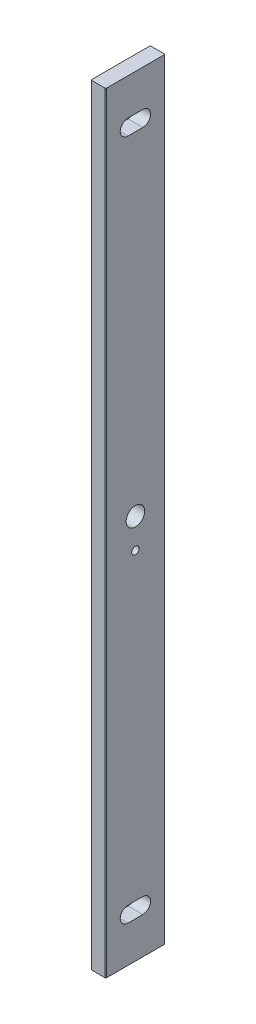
SolidWorks part; units mm, degrees
ref_plane "Plan de face" through (0, 0, 0) normal (0, 0, 1) x (1, 0, 0)
ref_plane "Plan de dessus" through (0, 0, 0) normal (0, 1, 0) x (1, 0, 0)
ref_plane "Plan de droite" through (0, 0, 0) normal (1, 0, 0) x (0, 0, -1)
ref_plane "Plan1" through (-5, 0, 0) normal (-1, 0, 0) x (0, -1, 0)
sketch "Esquisse1" plane through (-5, 0, 0) normal (-1, 0, 0) x (0, -1, 0)
  line L0 (-260, 20) -> (-260, -20)
  line L1 (-260, -20) -> (260, -20)
  line L2 (260, -20) -> (260, 20)
  line L3 (260, 20) -> (-260, 20)
extrude "Boss.-Extru.1" add sketch "Esquisse1" against normal blind 10
sketch "Esquisse2" plane through (-5, 0, 0) normal (-1, 0, 0) x (0, 0, 1)
  line L0 (5, 235.25) -> (-5, 235.25)
  line L1 (-5, 224.75) -> (5, 224.75)
  arc A0 (-5, 235.25) -> (-5, 224.75) centre (-5, 230) ccw
  arc A1 (5, 224.75) -> (5, 235.25) centre (5, 230) ccw
extrude "Enlèv. mat.-Extru.1" cut sketch "Esquisse2" against normal through all
sketch "Esquisse3" plane through (5, 0, 0) normal (1, 0, 0) x (0, 0, -1)
  line L0 (-5, -235.25) -> (5, -235.25)
  line L1 (5, -224.75) -> (-5, -224.75)
  arc A0 (5, -235.25) -> (5, -224.75) centre (5, -230) ccw
  arc A1 (-5, -224.75) -> (-5, -235.25) centre (-5, -230) ccw
extrude "Enlèv. mat.-Extru.2" cut sketch "Esquisse3" against normal through all
hole_wizard "Diamètre du perçage Ø5.0 (5)1" positions "Esquisse5" profile "Esquisse4" hole size "Ø5.0" standard "Ansi Metric"
sketch "Esquisse5" plane through (5, 0, 0) normal (1, 0, 0) x (0, 0, -1)
  point P0 (0, -20)
sketch "Esquisse4" plane through (5, -20, 0) normal (0, 1, 0) x (0, 0, -1)
  line L0 (0, 0) -> (0, 10)
  line L1 (0, 10) -> (2.5, 10)
  line L2 (2.5, 10) -> (2.5, 0)
  line L5 (2.5, 0) -> (0, 0)
  line L11 (0, -6.35) -> (0, 107.95) construction
  dimension "Diamètre du perçage jusqu'au prochain" = 5
  dimension "Profondeur du perçage jusqu'au prochain" = 10
hole_wizard "Diamètre du perçage Ø12.5 (12.5)1" positions "Esquisse7" profile "Esquisse6" hole size "Ø12.5" standard "Ansi Metric"
sketch "Esquisse7" plane through (5, 0, 0) normal (1, 0, 0) x (0, 0, -1)
  point P0 (0, 0)
sketch "Esquisse6" plane through (5, 0, 0) normal (0, 1, 0) x (0, 0, -1)
  line L0 (0, 0) -> (0, 10)
  line L1 (0, 10) -> (6.25, 10)
  line L2 (6.25, 10) -> (6.25, 0)
  line L5 (6.25, 0) -> (0, 0)
  line L11 (0, -6.35) -> (0, 107.95) construction
  dimension "Diamètre du perçage jusqu'au prochain" = 12.5
  dimension "Profondeur du perçage jusqu'au prochain" = 10
fillet "Congé1" radius 0.5 4 edges at (5, 0, 20) (5, 0, -20) (-5, 0, 20) (-5, 0, -20)
sketch "Esquisse9" plane through (-5, 0, 0) normal (-1, 0, 0) x (0, 0, 1)
  line L0 (10.25, -230) -> (-10.25, -230)
  line L1 (0, -235.25) -> (0, -224.75)
  line L2 (5, -235.25) -> (-5, -235.25) construction
  line L3 (-5, -224.75) -> (5, -224.75) construction
  arc A0 (5, -235.25) -> (5, -224.75) centre (5, -230) ccw construction
  arc A1 (-5, -224.75) -> (-5, -235.25) centre (-5, -230) ccw construction
  point P14 (0, -230)
sketch "Esquisse10" plane through (-5, 0, 0) normal (-1, 0, 0) x (0, 0, 1)
  line L0 (10.25, 230) -> (-10.25, 230)
  arc A0 (5, 224.75) -> (5, 235.25) centre (5, 230) ccw construction
  arc A1 (-5, 235.25) -> (-5, 224.75) centre (-5, 230) ccw construction
